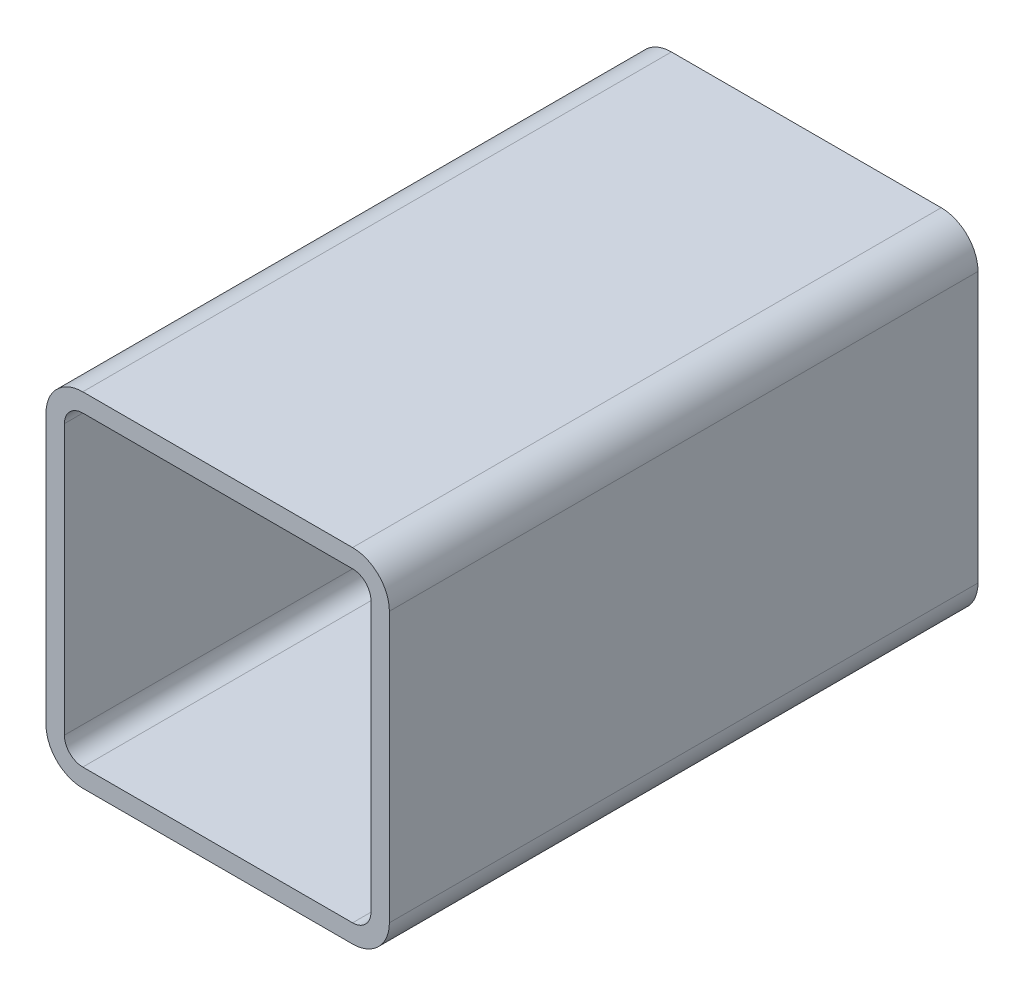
SolidWorks part; units mm, degrees
ref_plane "Front Plane" through (0, 0, 0) normal (0, 0, 1) x (1, 0, 0)
ref_plane "Top Plane" through (0, 0, 0) normal (0, 1, 0) x (1, 0, 0)
ref_plane "Right Plane" through (0, 0, 0) normal (1, 0, 0) x (0, 0, -1)
sketch "Sketch1" plane through (0, 0, 0) normal (0, 0, 1) x (1, 0, 0)
sketch_block_instance "HSS7x7x0.375-1"
sketch_block "HSS7x7x0.375"
extrude "Boss-Extrude1" add sketch "Sketch1" along normal blind 304.8
